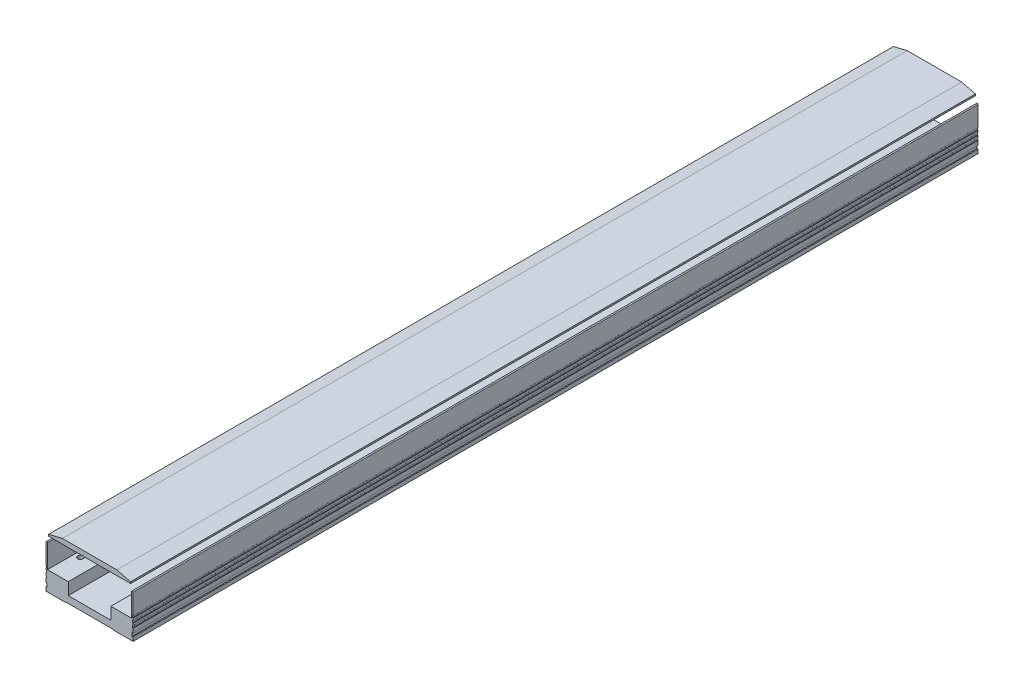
SolidWorks part; units mm, degrees
ref_plane "前视基准面" through (0, 0, 0) normal (0, 0, 1) x (1, 0, 0)
ref_plane "上视基准面" through (0, 0, 0) normal (0, 1, 0) x (1, 0, 0)
ref_plane "右视基准面" through (0, 0, 0) normal (1, 0, 0) x (0, 0, -1)
sketch "草图1" plane through (0, 0, 0) normal (0, 0, 1) x (1, 0, 0)
  line B0 (84.8, 100) -> (84.8, 103.28)
  line B1 (84.8, 103.28) -> (56.2812, 110.3)
  line B2 (56.2812, 110.3) -> (-56.2812, 110.3)
  line B3 (-56.2812, 110.3) -> (-84.8, 103.28)
  line B4 (-84.8, 103.28) -> (-84.8, 100)
  line B5 (-84.8, 100) -> (84.8, 100)
  line B6 (50, -1) -> (90, -1)
  line B7 (90, -1) -> (90, 7)
  line B8 (90, 7) -> (88, 7)
  line B9 (88, 7) -> (88, 14)
  line B10 (88, 14) -> (90, 14)
  line B11 (90, 14) -> (90, 22.7)
  line B12 (89.7, 23) -> (89.5, 23)
  line B13 (89.2, 23.3) -> (89.2, 26.7)
  line B14 (89.5, 27) -> (89.7, 27)
  line B15 (90, 27.3) -> (90, 31.7)
  line B16 (89.7, 32) -> (89.5, 32)
  line B17 (89.2, 32.3) -> (89.2, 35.7)
  line B18 (89.5, 36) -> (89.7, 36)
  line B19 (90, 36.3) -> (90, 40.7)
  line B20 (89.7, 41) -> (89.5, 41)
  line B21 (89.2, 41.3) -> (89.2, 44.7)
  line B22 (89.5, 45) -> (89.7, 45)
  line B23 (90, 45.3) -> (90, 87)
  line B24 (87, 87) -> (87, 39)
  line B25 (87, 39) -> (44, 39)
  line B26 (44, 39) -> (44, 14)
  line B27 (44, 14) -> (-44, 14)
  line B28 (-44, 14) -> (-44, 39)
  line B29 (-44, 39) -> (-87, 39)
  line B30 (-87, 39) -> (-87, 87)
  line B31 (-90, 87) -> (-90, 45.3)
  line B32 (-89.7, 45) -> (-89.5, 45)
  line B33 (-89.2, 44.7) -> (-89.2, 41.3)
  line B34 (-89.5, 41) -> (-89.7, 41)
  line B35 (-90, 40.7) -> (-90, 36.3)
  line B36 (-89.7, 36) -> (-89.5, 36)
  line B37 (-89.2, 35.7) -> (-89.2, 32.3)
  line B38 (-89.5, 32) -> (-89.7, 32)
  line B39 (-90, 31.7) -> (-90, 27.3)
  line B40 (-89.7, 27) -> (-89.5, 27)
  line B41 (-89.2, 26.7) -> (-89.2, 23.3)
  line B42 (-89.5, 23) -> (-89.7, 23)
  line B43 (-90, 22.7) -> (-90, 14)
  line B44 (-90, 14) -> (-88, 14)
  line B45 (-88, 14) -> (-88, 7)
  line B46 (-88, 7) -> (-90, 7)
  line B47 (-90, 7) -> (-90, -1)
  line B48 (-90, -1) -> (-50, -1)
  line B49 (-50, -1) -> (-50, 0)
  line B50 (-50, 0) -> (50, 0)
  line B51 (50, 0) -> (50, -1)
  arc B52 (90, 22.7) -> (89.7, 23) centre (89.7, 22.7) ccw
  arc B53 (89.2, 23.3) -> (89.5, 23) centre (89.5, 23.3) ccw
  arc B54 (89.5, 27) -> (89.2, 26.7) centre (89.5, 26.7) ccw
  arc B55 (89.7, 27) -> (90, 27.3) centre (89.7, 27.3) ccw
  arc B56 (90, 31.7) -> (89.7, 32) centre (89.7, 31.7) ccw
  arc B57 (89.2, 32.3) -> (89.5, 32) centre (89.5, 32.3) ccw
  arc B58 (89.5, 36) -> (89.2, 35.7) centre (89.5, 35.7) ccw
  arc B59 (89.7, 36) -> (90, 36.3) centre (89.7, 36.3) ccw
  arc B60 (90, 40.7) -> (89.7, 41) centre (89.7, 40.7) ccw
  arc B61 (89.2, 41.3) -> (89.5, 41) centre (89.5, 41.3) ccw
  arc B62 (89.5, 45) -> (89.2, 44.7) centre (89.5, 44.7) ccw
  arc B63 (89.7, 45) -> (90, 45.3) centre (89.7, 45.3) ccw
  arc B64 (90, 87) -> (87, 87) centre (88.5, 87) ccw
  arc B65 (-87, 87) -> (-90, 87) centre (-88.5, 87) ccw
  arc B66 (-90, 45.3) -> (-89.7, 45) centre (-89.7, 45.3) ccw
  arc B67 (-89.2, 44.7) -> (-89.5, 45) centre (-89.5, 44.7) ccw
  arc B68 (-89.5, 41) -> (-89.2, 41.3) centre (-89.5, 41.3) ccw
  arc B69 (-89.7, 41) -> (-90, 40.7) centre (-89.7, 40.7) ccw
  arc B70 (-90, 36.3) -> (-89.7, 36) centre (-89.7, 36.3) ccw
  arc B71 (-89.2, 35.7) -> (-89.5, 36) centre (-89.5, 35.7) ccw
  arc B72 (-89.5, 32) -> (-89.2, 32.3) centre (-89.5, 32.3) ccw
  arc B73 (-89.7, 32) -> (-90, 31.7) centre (-89.7, 31.7) ccw
  arc B74 (-90, 27.3) -> (-89.7, 27) centre (-89.7, 27.3) ccw
  arc B75 (-89.2, 26.7) -> (-89.5, 27) centre (-89.5, 26.7) ccw
  arc B76 (-89.5, 23) -> (-89.2, 23.3) centre (-89.5, 23.3) ccw
  arc B77 (-89.7, 23) -> (-90, 22.7) centre (-89.7, 22.7) ccw
sketch_block_instance "块1-1"
sketch_block "块1"
extrude "凸台-拉伸1" add sketch "草图1" along normal blind 1746
hole_wizard "打孔尺寸(%根据)内六角圆柱头螺钉的类型1" positions "草图2" profile "草图3" counterbore size "M6" standard "GB"
sketch "草图2" plane through (0, 39, 0) normal (0, 1, 0) x (1, 0, 0)
  line L0 (0, 0) -> (0, -99.2948) construction
  line L1 (-90, 0) -> (-50, 0) construction
  point P0 (-75, -90)
  point P7 (75, -90)
  dimension "D1" = 150
  dimension "D2" = 90
sketch "草图3" plane through (-75, 39, 90) normal (1, 0, 0) x (0, 0, 1)
  line L0 (0, 0) -> (0, 40)
  line L1 (0, 40) -> (3.3, 40)
  line L3 (3.3, 40) -> (3.3, 37.5)
  line L4 (3.3, 37.5) -> (5.5, 37.5)
  line L5 (5.5, 37.5) -> (5.5, 0)
  line L7 (5.5, 0) -> (0, 0)
  line L11 (0, -6.35) -> (0, 107.95) construction
  dimension "通孔孔直径" = 6.6
  dimension "通孔孔深度" = 40
  dimension "柱形沉头孔直径" = 11
  dimension "柱形沉头孔深度" = 37.5
hole_wizard "M8 螺纹孔1" positions "草图4" profile "草图5" tap size "M8" standard "GB"
sketch "草图4" plane through (0, -1, 0) normal (0, -1, 0) x (-1, 0, 0)
  line L0 (0, 0) -> (0, -97.4883) construction
  line L1 (50, 0) -> (-50, 0) construction
  point P0 (-65, -40)
  point P2 (65, -40)
  dimension "D1" = 130
  dimension "D2" = 40
sketch "草图5" plane through (65, -1, 40) normal (1, 0, 0) x (0, 0, -1)
  line L0 (0, 0) -> (0, 21.7929)
  line L1 (0, 21.7929) -> (3.4, 19.75)
  line L2 (3.4, 19.75) -> (3.4, 0)
  line L5 (3.4, 0) -> (0, 0)
  line L10 (0, 21.7929) -> (-3.4, 19.75) construction
  line L11 (0, -6.35) -> (0, 107.95) construction
  dimension "螺纹孔钻头直径" = 6.8
  dimension "螺纹孔钻头深度" = 19.75
  dimension "导头角度" = 118
pattern_linear "阵列(线性)1" count 18 spacing 100 along (0, 0, 1) of "打孔尺寸(%根据)内六角圆柱头螺钉的类型1", "M8 螺纹孔1"
